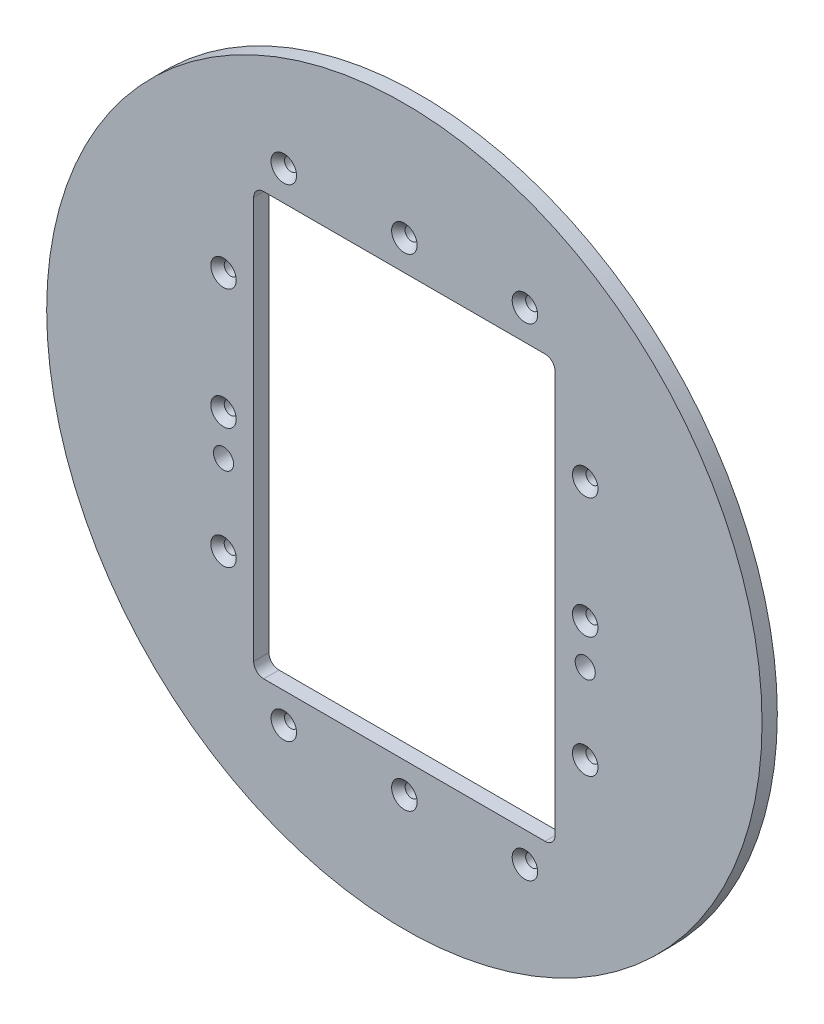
SolidWorks part; units mm, degrees
ref_plane "Front" through (0, 0, 0) normal (0, 0, 1) x (1, 0, 0)
ref_plane "Top" through (0, 0, 0) normal (0, 1, 0) x (1, 0, 0)
ref_plane "Right" through (0, 0, 0) normal (1, 0, 0) x (0, 0, -1)
sketch "Sketch1" plane through (0, 0, 0) normal (0, 0, 1) x (1, 0, 0)
  line L1 (95.25, 133.35) -> (-95.25, 133.35)
  line L2 (95.25, 133.35) -> (95.25, -133.35)
  line L3 (95.25, -133.35) -> (-95.25, -133.35)
  line L4 (-95.25, 133.35) -> (-95.25, -133.35)
  circle A0 centre (0, 0) radius 226.06
  circle A2 centre (0, 0) radius 227.838 construction
  point P8 (-226.06, 0)
  point P9 (226.06, 0)
  point P10 (0, -226.06)
  point P12 (0, 226.06)
  dimension "D1" = 452.12
  dimension "D2" = 133.35
  dimension "D3" = 455.676
  dimension "D4" = 133.35
  dimension "D5" = 95.25
  dimension "D6" = 95.25
extrude "Boss-Extrude1" add sketch "Sketch1" against normal blind 9.652
sketch "Sketch2" plane through (0, 0, 0) normal (0, 0, 1) x (1, 0, 0)
  line L0 (-114.3, 171.45) -> (-114.3, -171.45) construction
  line L1 (-95.25, 171.45) -> (95.25, 171.45) construction
  line L2 (-95.25, 171.45) -> (-95.25, 133.35) construction
  line L3 (-95.25, 133.35) -> (95.25, 133.35) construction
  line L4 (95.25, 171.45) -> (95.25, 133.35) construction
  line L5 (-95.25, -133.35) -> (95.25, -133.35) construction
  line L6 (-95.25, -133.35) -> (-95.25, -171.45) construction
  line L7 (-95.25, -171.45) -> (95.25, -171.45) construction
  line L8 (95.25, -133.35) -> (95.25, -171.45) construction
  line L9 (-133.35, 171.45) -> (-95.25, 171.45) construction
  line L10 (-133.35, 171.45) -> (-133.35, -171.45) construction
  line L11 (-133.35, -171.45) -> (-95.25, -171.45) construction
  line L12 (-95.25, 171.45) -> (-95.25, -171.45) construction
  line L13 (95.25, 171.45) -> (133.35, 171.45) construction
  line L14 (95.25, 171.45) -> (95.25, -171.45) construction
  line L15 (95.25, -171.45) -> (133.35, -171.45) construction
  line L16 (133.35, 171.45) -> (133.35, -171.45) construction
  line L17 (-95.25, -152.4) -> (95.25, -152.4) construction
  line L18 (114.3, 171.45) -> (114.3, -171.45) construction
  line L19 (95.25, 152.4) -> (-95.25, 152.4) construction
  point P4 (0, 171.45)
  point P5 (0, -171.45)
  point P15 (-133.35, 0)
  point P27 (0, 152.4)
  point P28 (38.1, 152.4)
  point P29 (76.2, 152.4)
  point P30 (-38.1, 152.4)
  point P31 (-38.1, -152.4)
  point P32 (0, -152.4)
  point P33 (38.1, -152.4)
  point P34 (76.2, -152.4)
  point P35 (-76.2, 152.4)
  point P36 (-114.3, 152.4)
  point P37 (-114.3, 114.3)
  point P38 (-114.3, 76.2)
  point P39 (-114.3, 50.8)
  point P40 (-114.3, 0)
  point P41 (-114.3, -50.8)
  point P42 (-114.3, -76.2)
  point P43 (-114.3, -114.3)
  point P44 (-114.3, -152.4)
  point P45 (114.3, 152.4)
  point P46 (114.3, 114.3)
  point P47 (114.3, 76.2)
  point P48 (114.3, 50.8)
  point P49 (114.3, 0)
  point P50 (114.3, -50.8)
  point P51 (114.3, -76.2)
  point P52 (114.3, -114.3)
  point P53 (114.3, -152.4)
  point P63 (-76.2, -152.4)
hole_wizard "CSK for 5/16 Flat Head Machine Screw1" positions "Sketch5" profile "Sketch6" countersink size "5/16" standard "ANSI Inch"
sketch "Sketch5" plane through (0, 0, 0) normal (0, 0, 1) x (1, 0, 0)
  point P0 (0, 152.4)
  point P3 (0, -152.4)
  point P6 (114.3, 76.2)
  point P15 (114.3, -76.2)
  point P21 (114.3, 0)
  point P24 (-114.3, 76.2)
  point P30 (-114.3, 0)
  point P33 (-114.3, -76.2)
  point P56 (-76.2, 152.4)
  point P59 (76.2, 152.4)
  point P62 (-76.2, -152.4)
  point P65 (76.2, -152.4)
sketch "Sketch6" plane through (0, 152.4, 0) normal (1, 0, 0) x (0, -1, 0)
  line L0 (0, 0) -> (0, 9.652)
  line L1 (0, 9.652) -> (4.1021, 9.652)
  line L2 (4.1021, 9.652) -> (4.1021, 4.5582)
  line L3 (4.1021, 4.5582) -> (8.0645, 0)
  line L5 (8.0645, 0) -> (0, 0)
  line L6 (-4.1021, 4.5582) -> (-8.0645, 0) construction
  line L11 (0, -6.35) -> (0, 107.95) construction
  dimension "Thru Hole Dia." = 8.2042
  dimension "Thru Hole Depth" = 9.652
  dimension "Near C'Sink Dia." = 16.129
  dimension "Near C'Sink Angle" = 82
sketch "Sketch7" plane through (0, 0, 0) normal (0, 0, 1) x (1, 0, 0)
  line L0 (-114.3, 171.45) -> (-114.3, -171.45) construction
  line L1 (114.3, 171.45) -> (114.3, -171.45) construction
  line L2 (-95.25, -152.4) -> (95.25, -152.4) construction
  point P0 (-114.3, -25.4)
  point P1 (114.3, -25.4)
  dimension "D1" = 127
hole_wizard "1/2 (0.5) Diameter Hole1" positions "Sketch8" profile "Sketch9" hole size "1/2" standard "ANSI Inch"
sketch "Sketch8" plane through (0, 0, 0) normal (0, 0, 1) x (1, 0, 0)
  point P0 (-114.3, -25.4)
  point P3 (114.3, -25.4)
sketch "Sketch9" plane through (-114.3, -25.4, 0) normal (1, 0, 0) x (0, -1, 0)
  line L0 (0, 0) -> (0, 9.652)
  line L1 (0, 9.652) -> (6.35, 9.652)
  line L2 (6.35, 9.652) -> (6.35, 0)
  line L5 (6.35, 0) -> (0, 0)
  line L11 (0, -6.35) -> (0, 107.95) construction
  dimension "Thru Hole Dia." = 12.7
  dimension "Thru Hole Depth" = 9.652
ref_plane "Plane1" through (0, -25.4, 0) normal (0, 1, 0) x (1, 0, 0)
fillet "Fillet1" radius 6.35 4 edges at (95.25, 133.35, -4.826) (-95.25, 133.35, -4.826) (95.25, -133.35, -4.826) (-95.25, -133.35, -4.826)
equation "\"var\"= 1in"
equation "\"D18@Sketch2\"=\"D17@Sketch2\""
